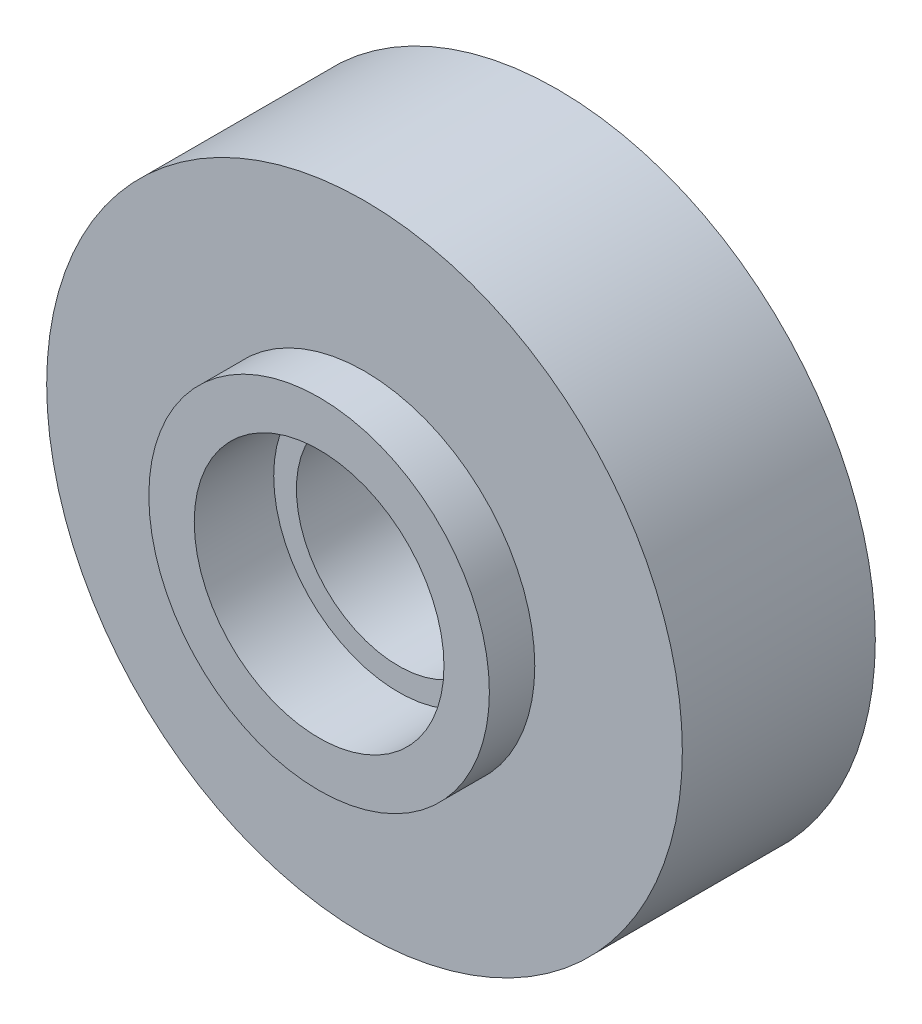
SolidWorks part; units mm, degrees
ref_plane "Front Plane" through (0, 0, 0) normal (0, 0, 1) x (1, 0, 0)
ref_plane "Top Plane" through (0, 0, 0) normal (0, 1, 0) x (1, 0, 0)
ref_plane "Right Plane" through (0, 0, 0) normal (1, 0, 0) x (0, 0, -1)
sketch "Sketch1" plane through (0, 0, 0) normal (0, 0, 1) x (1, 0, 0)
  circle A0 centre (0, 0) radius 28
  dimension "D1" = 56
extrude "Boss-Extrude1" add sketch "Sketch1" along normal blind 17
sketch "Sketch2" plane through (0, 0, 17) normal (0, 0, 1) x (1, 0, 0)
  circle A0 centre (0, 0) radius 11
extrude "Cut-Extrude1" cut sketch "Sketch2" against normal blind 3
sketch "Sketch3" plane through (0, 0, 14) normal (0, 0, 1) x (1, 0, 0)
  circle A0 centre (0, 0) radius 9
extrude "Cut-Extrude2" cut sketch "Sketch3" against normal through all
sketch "Sketch4" plane through (0, 0, 0) normal (0, 0, -1) x (-1, 0, 0)
  circle A0 centre (0, 0) radius 11
extrude "Cut-Extrude3" cut sketch "Sketch4" against normal blind 6.5
sketch "Sketch6" plane through (0, 0, 17) normal (0, 0, 1) x (1, 0, 0)
  circle A0 centre (0, 0) radius 15
  circle A1 centre (0, 0) radius 11
extrude "Boss-Extrude2" add sketch "Sketch6" along normal blind 4
